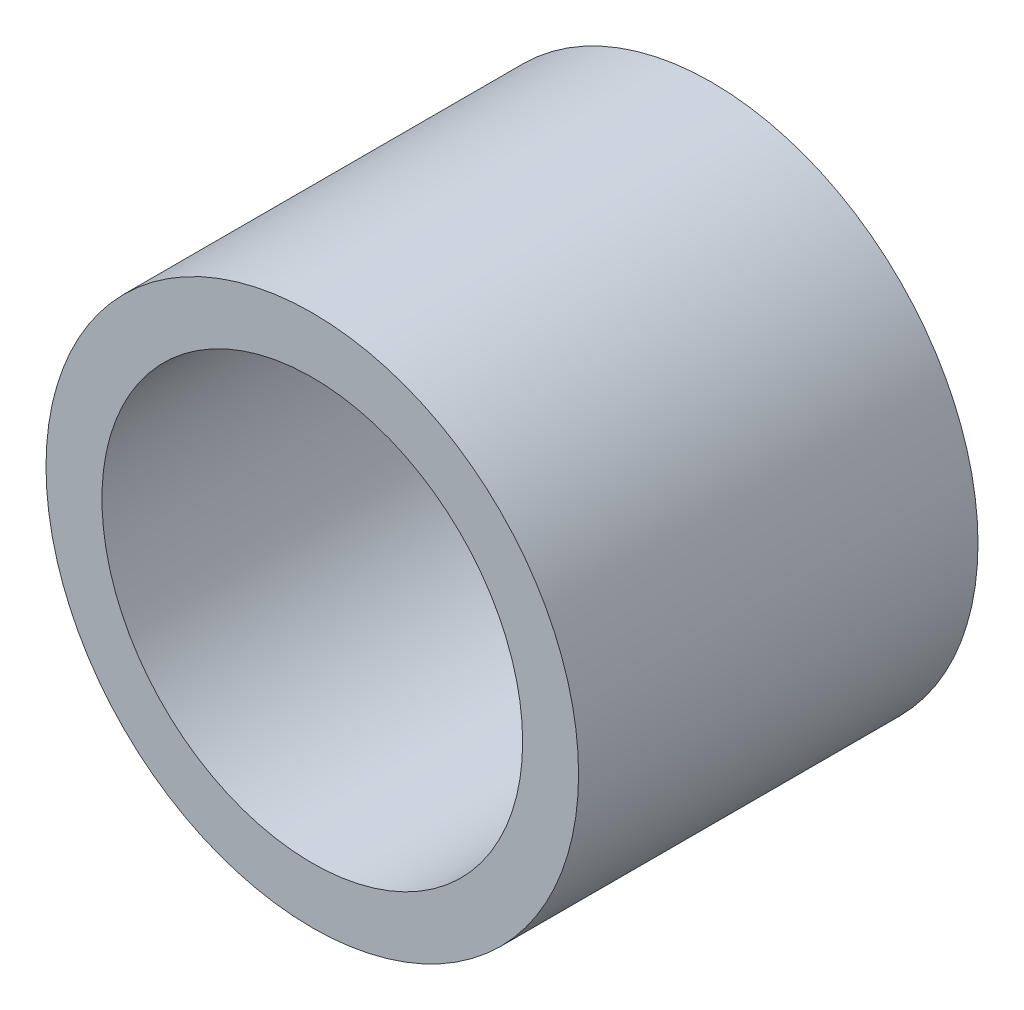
SolidWorks part; units mm, degrees
ref_plane "正面" through (0, 0, 0) normal (0, 0, 1) x (1, 0, 0)
ref_plane "平面" through (0, 0, 0) normal (0, 1, 0) x (1, 0, 0)
ref_plane "右側面" through (0, 0, 0) normal (1, 0, 0) x (0, 0, -1)
sketch "ｽｹｯﾁ1" plane through (0, 0, 0) normal (0, 0, 1) x (1, 0, 0)
  circle A0 centre (0, 0) radius 10
  dimension "D1" = 20
extrude "ﾎﾞｽ - 押し出し1" add sketch "ｽｹｯﾁ1" along normal blind 15
sketch "ｽｹｯﾁ2" plane through (0, 0, 0) normal (0, 0, 1) x (1, 0, 0)
  circle A0 centre (0, 0) radius 7.9
  dimension "D1" = 15.8
extrude "ｶｯﾄ - 押し出し1" cut sketch "ｽｹｯﾁ2" along normal through all
